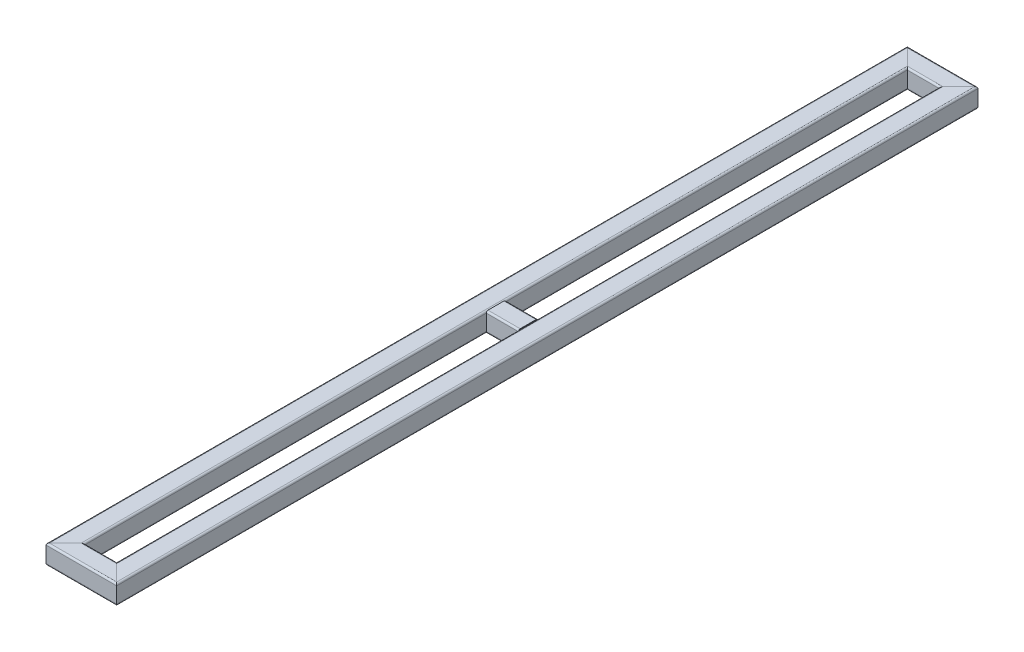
SolidWorks part; units mm, degrees
ref_plane "Plan de face" through (0, 0, 0) normal (0, 0, 1) x (1, 0, 0)
ref_plane "Plan de dessus" through (0, 0, 0) normal (0, 1, 0) x (1, 0, 0)
ref_plane "Plan de droite" through (0, 0, 0) normal (1, 0, 0) x (0, 0, -1)
sketch3d "Esquisse3D1"
  line L0 (0, 0, 0) -> (120, 0, 0)
  line L1 (120, 0, 0) -> (120, 0, -1965)
  line L2 (120, 0, -1965) -> (0, 0, -1965)
  line L3 (0, 0, -1965) -> (0, 0, 0)
  line L4 (0, 0, -982.5) -> (120, 0, -982.5)
  dimension "D1" = 120
  dimension "D2" = 1965
other "Elément mécano-soudé1"
ref_plane "Plan1" through (0, 0, -1965) normal (0, 0, 1) x (1, 0, 0)
sketch "Sketch11" plane through (0, 0, -1965) normal (0, 0, 1) x (1, 0, 0)
  line L0 (-18.5, -20.5) -> (18.5, -20.5)
  line L1 (-20.5, -18.5) -> (-20.5, 18.5)
  line L2 (18.5, 20.5) -> (-18.5, 20.5)
  line L3 (20.5, 18.5) -> (20.5, -18.5)
  line L4 (-18.5, -22.5) -> (18.5, -22.5)
  line L5 (-22.5, -18.5) -> (-22.5, 18.5)
  line L6 (18.5, 22.5) -> (-18.5, 22.5)
  line L7 (22.5, 18.5) -> (22.5, -18.5)
  arc A0 (22.5, 18.5) -> (18.5, 22.5) centre (18.5, 18.5) ccw
  arc A1 (18.5, -22.5) -> (22.5, -18.5) centre (18.5, -18.5) ccw
  arc A2 (-22.5, -18.5) -> (-18.5, -22.5) centre (-18.5, -18.5) ccw
  arc A3 (-18.5, 22.5) -> (-22.5, 18.5) centre (-18.5, 18.5) ccw
  arc A4 (-18.5, 20.5) -> (-20.5, 18.5) centre (-18.5, 18.5) ccw
  arc A5 (20.5, 18.5) -> (18.5, 20.5) centre (18.5, 18.5) ccw
  arc A6 (18.5, -20.5) -> (20.5, -18.5) centre (18.5, -18.5) ccw
  arc A7 (-20.5, -18.5) -> (-18.5, -20.5) centre (-18.5, -18.5) ccw
  point P0 (-22.5, 0)
  point P1 (22.5, 0)
  point P2 (0, 22.5)
  point P3 (0, -22.5)
  point P4 (0, 0)
  point P5 (-22.5, -22.5)
  point P6 (22.5, -22.5)
  point P7 (22.5, 22.5)
  point P8 (-22.5, 22.5)
  point P33 (0, 0)
  dimension "D1" = 4
  dimension "Thickness" = 2
  dimension "V_leg" = 45
